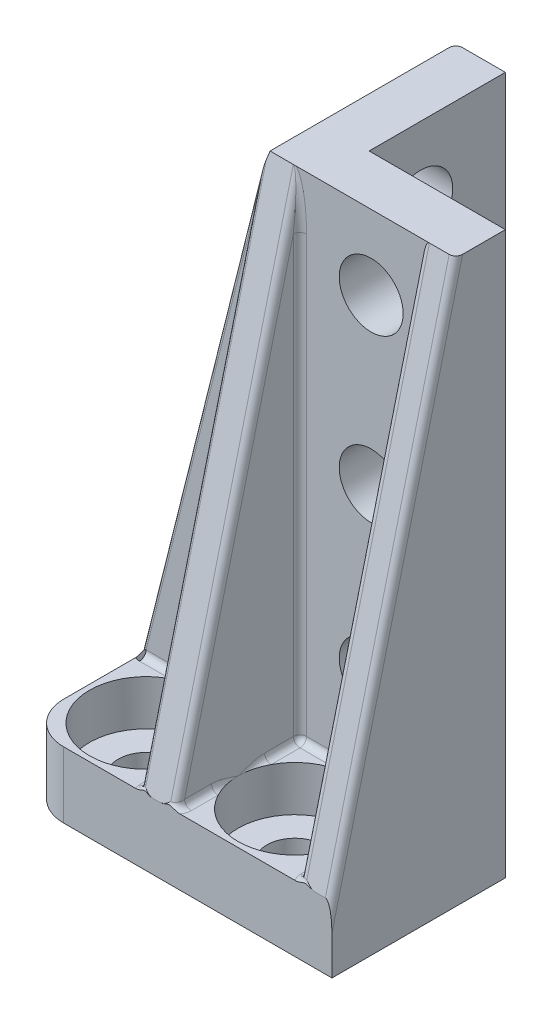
SolidWorks part; units mm, degrees
ref_plane "Front Plane" through (0, 0, 0) normal (0, 0, 1) x (1, 0, 0)
ref_plane "Top Plane" through (0, 0, 0) normal (0, 1, 0) x (1, 0, 0)
ref_plane "Right Plane" through (0, 0, 0) normal (1, 0, 0) x (0, 0, -1)
sketch "Sketch1" plane through (0, 0, 0) normal (0, 1, 0) x (1, 0, 0)
  line L0 (0, 0) -> (0, 7.9375)
  line L1 (0, 7.9375) -> (-3.81, 7.9375)
  line L2 (-3.81, 7.9375) -> (-3.81, -3.81)
  line L3 (-3.81, -3.81) -> (7.9375, -3.81)
  line L4 (7.9375, -3.81) -> (7.9375, 0)
  line L5 (7.9375, 0) -> (0, 0)
  dimension "D1" = 3.81
  dimension "D2" = 3.81
  dimension "D3" = 7.9375
  dimension "D4" = 7.9375
extrude "Boss-Extrude1" add sketch "Sketch1" along normal blind 43.18
sketch "Sketch2" plane through (0, 0, 0) normal (0, -1, 0) x (1, 0, 0)
  line L0 (7.9375, 3.81) -> (-3.81, 3.81)
  line L1 (-3.81, 3.81) -> (-3.81, -7.9375)
  line L2 (-3.81, -7.9375) -> (-13.335, -7.9375)
  line L3 (-13.335, -7.9375) -> (-13.335, 13.335)
  line L4 (-13.335, 13.335) -> (7.9375, 13.335)
  line L5 (7.9375, 13.335) -> (7.9375, 3.81)
  line L6 (0, 0) -> (0, -7.9375) construction
  line L7 (7.9375, 0) -> (0, 0) construction
  dimension "D1" = 13.335
  dimension "D2" = 13.335
extrude "Boss-Extrude2" add sketch "Sketch2" against normal blind 5.08
hole_wizard "CBORE for #8 Button Head Cap Screw1" positions "Sketch5" profile "Sketch4" counterbore size "#8" standard "ANSI Inch"
sketch "Sketch5" plane through (0, 5.08, 0) normal (0, 1, 0) x (1, 0, 0)
  line L0 (-8.5725, 7.9375) -> (-8.5725, -8.5725) construction
  line L1 (-13.335, 7.9375) -> (-3.81, 7.9375) construction
  line L2 (7.9375, -8.5725) -> (-8.5725, -8.5725) construction
  line L3 (7.9375, -3.81) -> (7.9375, -13.335) construction
  line L5 (7.9375, 0) -> (0, 0) construction
  line L6 (0, 0) -> (0, 7.9375) construction
  line L7 (7.9375, -3.81) -> (7.9375, -13.335) construction
  line L8 (-13.335, 7.9375) -> (-3.81, 7.9375) construction
  point P0 (-8.5725, 2.8575)
  point P2 (-8.5725, -8.5725)
  point P4 (2.8575, -8.5725)
  dimension "D1" = 5.08
  dimension "D2" = 5.08
  dimension "D3" = 8.5725
  dimension "D4" = 8.5725
sketch "Sketch4" plane through (-8.5725, 5.08, -2.8575) normal (1, 0, 0) x (0, 0, 1)
  line L0 (0, 0) -> (0, 5.08)
  line L1 (0, 5.08) -> (2.1526, 5.08)
  line L3 (2.1526, 5.08) -> (2.1526, 3.4798)
  line L4 (2.1526, 3.4798) -> (4.3663, 3.4798)
  line L5 (4.3663, 3.4798) -> (4.3663, 0)
  line L7 (4.3663, 0) -> (0, 0)
  line L11 (0, -6.35) -> (0, 107.95) construction
  dimension "Thru Hole Dia." = 4.3053
  dimension "Thru Hole Depth" = 5.08
  dimension "C'Bore Dia." = 8.7325
  dimension "C'Bore Depth" = 3.4798
sketch "Sketch14" plane through (7.9375, 0, 0) normal (1, 0, 0) x (0, 0, -1)
  line L0 (0, 43.18) -> (-3.81, 43.18)
  line L1 (-3.81, 43.18) -> (-13.335, 5.08)
  line L2 (-13.335, 5.08) -> (-13.335, 0)
  line L3 (-13.335, 0) -> (0, 0)
  line L4 (0, 0) -> (0, 43.18)
extrude "Boss-Extrude4" add sketch "Sketch14" along normal blind 2.54
sketch "Sketch15" plane through (0, 0, -7.9375) normal (0, 0, -1) x (-1, 0, 0)
  line L0 (0, 43.18) -> (0, 0)
  line L1 (0, 0) -> (13.335, 0)
  line L2 (13.335, 0) -> (13.335, 5.08)
  line L3 (13.335, 5.08) -> (3.81, 43.18)
  line L4 (0, 43.18) -> (3.81, 43.18) construction
  line L5 (3.81, 43.18) -> (3.81, 5.08) construction
  line L6 (3.81, 43.18) -> (0, 43.18)
extrude "Boss-Extrude5" add sketch "Sketch15" along normal blind 2.54
fillet "Fillet1" radius 3.175 1 edges at (-13.335, 2.54, 13.335)
hole_wizard "#10 (0.1935) Diameter Hole2" positions "Sketch7" profile "Sketch6" hole size "#10" standard "ANSI Inch"
sketch "Sketch7" plane through (-3.81, 0, 0) normal (-1, 0, 0) x (0, 0, 1)
  circle A0 centre (-3.9687, 12.065) radius 1.7272 construction
  point P0 (-3.9687, 12.065)
  point P6 (-3.9687, 24.765)
  point P9 (-3.9687, 37.465)
  dimension "D1" = 12.7
  dimension "D2" = 12.7
sketch "Sketch6" plane through (-3.81, 12.065, -3.9687) normal (0, 1, 0) x (0, 0, 1)
  line L0 (0, 0) -> (0, 14.2875)
  line L1 (0, 14.2875) -> (2.4574, 14.2875)
  line L2 (2.4574, 14.2875) -> (2.4574, 0)
  line L5 (2.4574, 0) -> (0, 0)
  line L11 (0, -6.35) -> (0, 107.95) construction
  dimension "Thru Hole Dia." = 4.9149
  dimension "Thru Hole Depth" = 14.2875
hole_wizard "#10 (0.1935) Diameter Hole3" positions "Sketch9" profile "Sketch8" hole size "#10" standard "ANSI Inch"
sketch "Sketch9" plane through (0, 0, 3.81) normal (0, 0, 1) x (1, 0, 0)
  circle A0 centre (3.9688, 24.765) radius 1.7272 construction
  point P0 (3.9688, 24.765)
  point P5 (3.9688, 12.065)
  point P6 (3.9688, 37.465)
  dimension "D1" = 12.7
  dimension "D2" = 12.7
sketch "Sketch8" plane through (3.9688, 24.765, 3.81) normal (1, 0, 0) x (0, -1, 0)
  line L0 (0, 0) -> (0, 14.2875)
  line L1 (0, 14.2875) -> (2.4574, 14.2875)
  line L2 (2.4574, 14.2875) -> (2.4574, 0)
  line L5 (2.4574, 0) -> (0, 0)
  line L11 (0, -6.35) -> (0, 107.95) construction
  dimension "Thru Hole Dia." = 4.9149
  dimension "Thru Hole Depth" = 14.2875
sketch "Sketch10" plane through (0, 43.18, 0) normal (0, 1, 0) x (1, 0, 0)
  line L0 (-3.81, -1.5088) -> (-3.81, -3.81)
  line L1 (-3.81, 7.9375) -> (-3.81, -3.81) construction
  line L2 (-3.81, -3.81) -> (-1.5088, -3.81)
  line L3 (-3.81, -3.81) -> (7.9375, -3.81) construction
  line L4 (-1.5088, -3.81) -> (-1.5088, -13.335)
  line L5 (7.9375, -13.335) -> (-10.16, -13.335) construction
  line L6 (-1.5088, -13.335) -> (-4.2062, -13.335)
  line L7 (-4.2062, -13.335) -> (-4.2062, -4.2062)
  line L8 (-4.2062, -4.2062) -> (-13.335, -4.2062)
  line L9 (-13.335, -10.16) -> (-13.335, 7.9375) construction
  line L10 (-13.335, -4.2062) -> (-13.335, -1.5088)
  line L11 (-13.335, -1.5088) -> (-3.81, -1.5088)
  circle A0 centre (-8.5725, 2.8575) radius 4.3663 construction
  circle A1 centre (-8.5725, -8.5725) radius 4.3663 construction
  circle A2 centre (-8.5725, -8.5725) radius 4.3663 construction
  circle A3 centre (2.8575, -8.5725) radius 4.3663 construction
extrude "Boss-Extrude3" add sketch "Sketch10" against normal up to surface (38.1 mm away)
sketch "Sketch11" plane through (-1.5088, 0, 0) normal (1, 0, 0) x (0, 0, -1)
  line L0 (-3.81, 43.18) -> (-13.335, 43.18)
  line L1 (-13.335, 43.18) -> (-13.335, 5.08)
  line L2 (-13.335, 5.08) -> (-3.81, 43.18)
extrude "Cut-Extrude1" cut sketch "Sketch11" against normal through all
sketch "Sketch12" plane through (0, 0, 1.5088) normal (0, 0, -1) x (-1, 0, 0)
  line L0 (3.81, 43.18) -> (13.335, 5.08)
  line L1 (13.335, 5.08) -> (13.335, 43.18)
  line L2 (13.335, 43.18) -> (3.81, 43.18)
extrude "Cut-Extrude2" cut sketch "Sketch12" against normal through all
fillet "Fillet10" radius 0.254 2 edges at (-4.2062, 23.3375, 8.7706) (-8.7706, 23.3375, 4.2062)
fillet "Fillet9" radius 0.508 6 edges at (10.4775, 24.13, 8.5725) (7.9375, 24.13, 8.5725) (-1.5088, 24.13, 8.5725) (-8.5725, 24.13, -10.4775) (-8.5725, 24.13, 1.5088) (-8.5725, 24.13, -7.9375)
fillet "Fillet11" radius 0.508 24 edges at (8.0863, 5.08, 13.1816) (-1.6575, 42.5665, 3.81) (-1.5088, 5.08, 6.1913) (-1.6575, 5.08, 13.1816) (-4.1318, 5.08, 13.2583) (-4.2062, 5.08, 6.3894) (-4.1862, 41.0362, 4.1862) (-6.3894, 5.08, 4.2062) (-13.2583, 5.08, 4.1318) (-13.1816, 5.08, 1.6575) (-6.1913, 5.08, 1.5088) (-13.1816, 5.08, -8.0863) (-3.81, 42.5665, 1.6575) (7.9375, 5.08, 8.3107) (-1.5088, 23.0827, 3.81) (3.2144, 5.08, 3.81) (-1.5088, 5.08, 10.6919) (-4.2062, 5.08, 10.8228) (-4.2062, 22.8139, 4.2062) (-10.8228, 5.08, 4.2062) (-10.6919, 5.08, 1.5088) (-8.3107, 5.08, -7.9375) (-3.81, 5.08, -3.2144) (-3.81, 23.0827, 1.5088)
